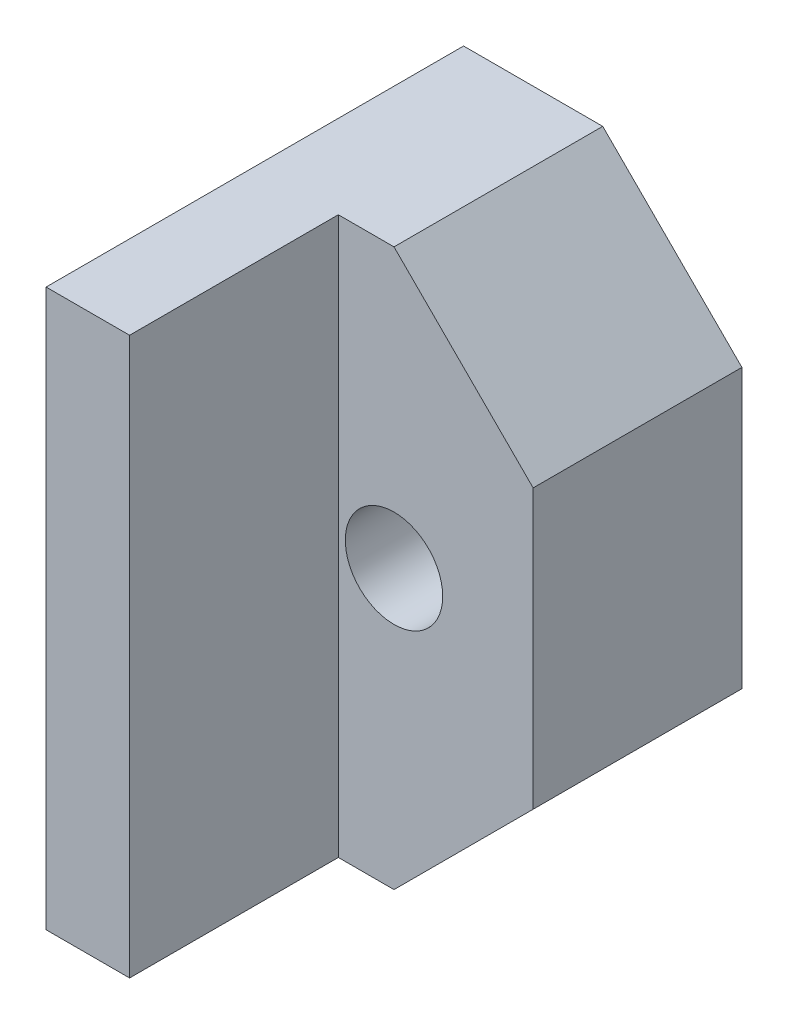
SolidWorks part; units mm, degrees
ref_plane "Front Plane" through (0, 0, 0) normal (0, 0, 1) x (1, 0, 0)
ref_plane "Top Plane" through (0, 0, 0) normal (0, 1, 0) x (1, 0, 0)
ref_plane "Right Plane" through (0, 0, 0) normal (1, 0, 0) x (0, 0, -1)
sketch "Sketch1" plane through (0, 0, 0) normal (0, 0, 1) x (1, 0, 0)
  line L0 (0, -4) -> (0, 4)
  line L1 (0, 4) -> (2, 4)
  line L2 (2, 4) -> (4, 2)
  line L3 (4, 2) -> (4, -2)
  line L4 (4, -2) -> (2, -4)
  line L5 (2, -4) -> (0, -4)
  line L6 (2, 4) -> (2, -4) construction
  line L7 (0, 0) -> (4, 0) construction
  circle A0 centre (2, 0) radius 0.7
  point P4 (0, 0)
  dimension "D5" = 1.4
  dimension "D1" = 8
  dimension "D2" = 2
  dimension "D3" = 2
  dimension "D4" = 4
extrude "Boss-Extrude1" add sketch "Sketch1" along normal blind 6 contours L0 L1 L2 L3 L4 L5 | A0
sketch "Sketch2" plane through (0, 0, 6) normal (0, 0, 1) x (1, 0, 0)
  line L0 (1.2, 4) -> (1.2, -4)
  line L6 (0, -4) -> (2, -4)
  line L7 (2, -4) -> (4, -2)
  line L8 (4, -2) -> (4, 2)
  line L9 (4, 2) -> (2, 4)
  line L10 (2, 4) -> (0, 4)
  line L11 (0, 4) -> (0, -4)
  line L12 (0, -4) -> (2, -4)
  line L13 (2, -4) -> (4, -2)
  line L14 (4, -2) -> (4, 2)
  line L15 (4, 2) -> (2, 4)
  line L16 (2, 4) -> (0, 4)
  line L17 (0, 4) -> (0, -4)
  circle A0 centre (2, 0) radius 0.7 construction
  circle A1 centre (2, 0) radius 0.7
  dimension "D2" = 0.8
  dimension "D1" = 0
extrude "Cut-Extrude3" cut sketch "Sketch2" against normal blind 3 contours L0 M12 M8 M9 M10 M11 M14
